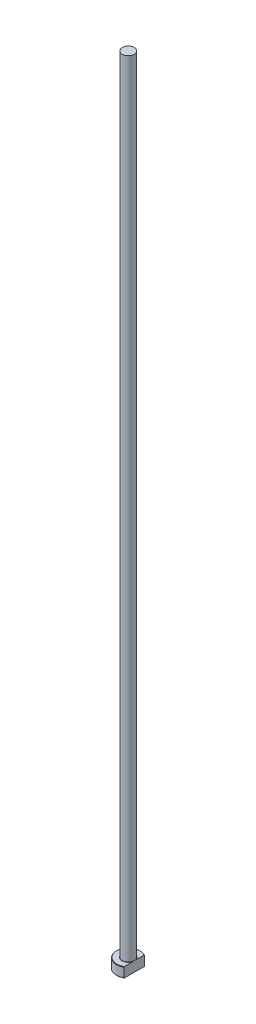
SolidWorks part; units mm, degrees
ref_plane "Front Plane" through (0, 0, 0) normal (0, 0, 1) x (1, 0, 0)
ref_plane "Top Plane" through (0, 0, 0) normal (0, 1, 0) x (1, 0, 0)
ref_plane "Right Plane" through (0, 0, 0) normal (1, 0, 0) x (0, 0, -1)
sketch "Sketch1" plane through (0, 0, 0) normal (0, 0, 1) x (1, 0, 0)
  line L0 (0, 259.9588) -> (0, -15.1925) construction
  line L1 (0, 0) -> (-6, 0)
  line L2 (-6, 0) -> (-6, 5)
  line L3 (-6, 5) -> (-3, 5)
  line L4 (-3, 5) -> (-3, 400)
  line L5 (-3, 400) -> (0, 400)
  line L6 (0, 400) -> (0, 0)
  dimension "L" = 400
  dimension "H" = 12
  dimension "T" = 5
  dimension "D" = 6
revolve "Revolve1" add sketch "Sketch1" angle 360 about L0
chamfer "Chamfer1" distance 0.2 angle 45 2 edges at (0, 5, 6) (0, 0, 6)
fillet "Fillet1" radius 0.2 1 edges at (0, 5, 3)
sketch "Sketch2" plane through (0, 0, 0) normal (0, 1, 0) x (1, 0, 0)
  line L0 (3, 5.1962) -> (3, -5.1962)
  circle A0 centre (0, 0) radius 6 construction
  arc A1 (3, -5.1962) -> (3, 5.1962) centre (0, 0) ccw
  circle A2 centre (0, 0) radius 3 construction
extrude "KEY" cut sketch "Sketch2" along normal through all
